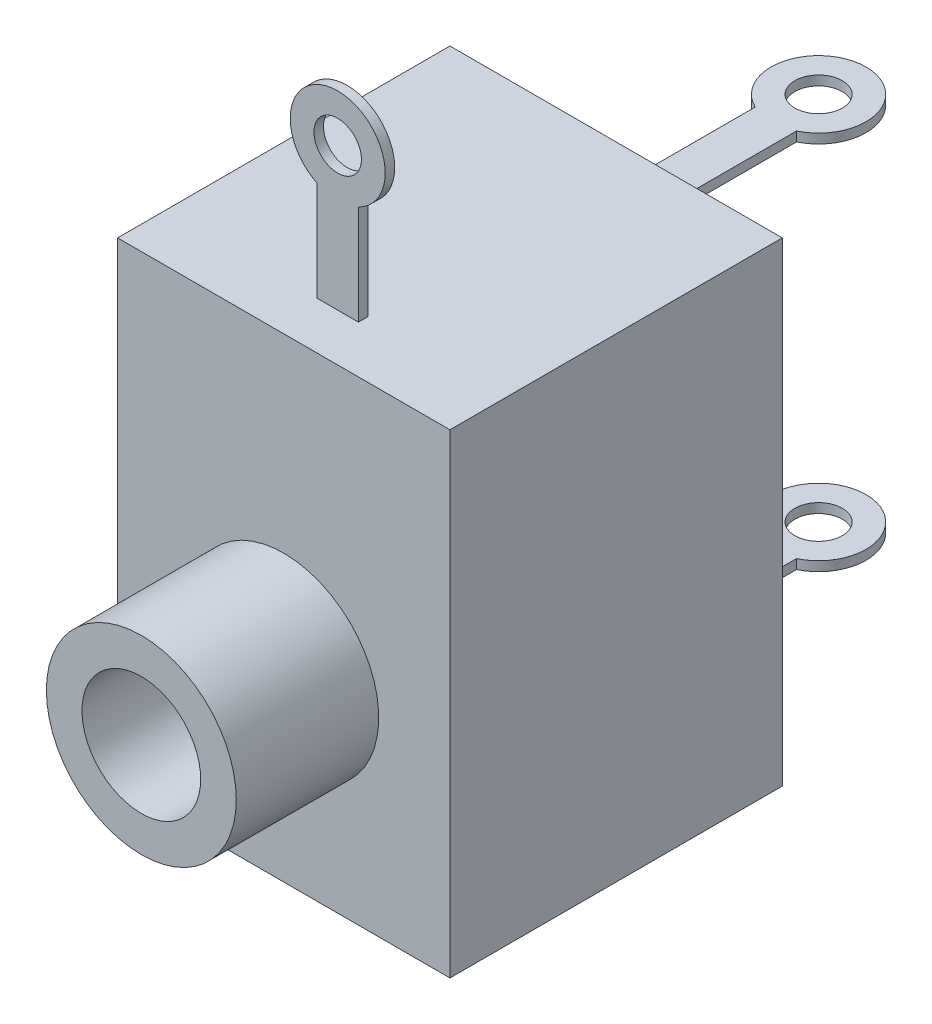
SolidWorks part; units mm, degrees
ref_plane "Plan de face" through (0, 0, 0) normal (0, 0, 1) x (1, 0, 0)
ref_plane "Plan de dessus" through (0, 0, 0) normal (0, 1, 0) x (1, 0, 0)
ref_plane "Plan de droite" through (0, 0, 0) normal (1, 0, 0) x (0, 0, -1)
sketch "Esquisse1" plane through (0, 0, 0) normal (0, 0, 1) x (1, 0, 0)
  line L1 (0, 0) -> (7, 0)
  line L2 (0, 0) -> (0, 10)
  line L3 (0, 10) -> (7, 10)
  line L4 (7, 0) -> (7, 10)
  dimension "D1" = 10
  dimension "D2" = 7
extrude "Extrusion1" add sketch "Esquisse1" along normal blind 7
shell "Coque1" thickness 1
sketch "Esquisse2" plane through (0, 0, 7) normal (0, 0, 1) x (1, 0, 0)
  line L0 (0, 0) -> (7, 0) construction
  line L1 (7, 0) -> (7, 10) construction
  circle A0 centre (3.5, 4) radius 2
  dimension "D1" = 4
  dimension "D2" = 4
  dimension "D3" = 3.5
extrude "Extrusion2" add sketch "Esquisse2" along normal blind 3
sketch "Esquisse3" plane through (0, 0, 10) normal (0, 0, 1) x (1, 0, 0)
  circle A0 centre (3.5, 4) radius 1.25
  circle A1 centre (3.5, 4) radius 2 construction
  dimension "D1" = 2.5
extrude "Enlèv. mat.-Extru.1" cut sketch "Esquisse3" against normal through all
sketch "Esquisse4" plane through (0, 9, 0) normal (0, -1, 0) x (1, 0, 0)
  line L0 (6, 0) -> (1, 0) construction
  line L1 (4.2, 0) -> (3.3282, 0)
  line L2 (4.2, 0) -> (4.2, -3.1)
  line L4 (3.3282, 0) -> (3.3282, -3.1)
  arc A0 (4.2, -3.1) -> (3.3282, -3.1) centre (3.7641, -4) cw
  circle A1 centre (3.7641, -4) radius 0.5
  dimension "D1" = 1
  dimension "D2" = 4
  dimension "D3" = 1
  dimension "D4" = 3.1
  dimension "D5" = 1.8
extrude "Extrusion3" add sketch "Esquisse4" along normal blind 0.2
sketch "Esquisse6" plane through (0, 1, 0) normal (0, 1, 0) x (1, 0, 0)
  line L0 (1, 0) -> (6, 0) construction
  line L1 (4.2, 0) -> (3.3282, 0)
  line L2 (4.2, 0) -> (4.2, 3.1)
  line L4 (3.3282, 0) -> (3.3282, 3.1)
  arc A0 (4.2, 3.1) -> (3.3282, 3.1) centre (3.7641, 4) ccw
  circle A1 centre (3.7641, 4) radius 0.5
  dimension "D2" = 1
  dimension "D3" = 1
  dimension "D5" = 4
  dimension "D1" = 3.1
  dimension "D4" = 1.8
extrude "Extrusion5" add sketch "Esquisse6" along normal blind 0.2
sketch "Esquisse7" plane through (0, 0, 6) normal (0, 0, -1) x (-1, 0, 0)
  line L0 (-6, 9) -> (-1, 9) construction
  line L1 (-4.0718, 9) -> (-3.2001, 9)
  line L2 (-4.0718, 9) -> (-4.0718, 12.1)
  line L4 (-3.2001, 9) -> (-3.2001, 12.1)
  line L5 (-3.6359, 13) -> (-3.6359, 9) construction
  arc A0 (-4.0718, 12.1) -> (-3.2001, 12.1) centre (-3.6359, 13) cw
  circle A1 centre (-3.6359, 13) radius 0.5
  dimension "D2" = 1
  dimension "D1" = 1
  dimension "D3" = 3.1
  dimension "D4" = 4
extrude "Extrusion6" add sketch "Esquisse7" along normal blind 0.2
